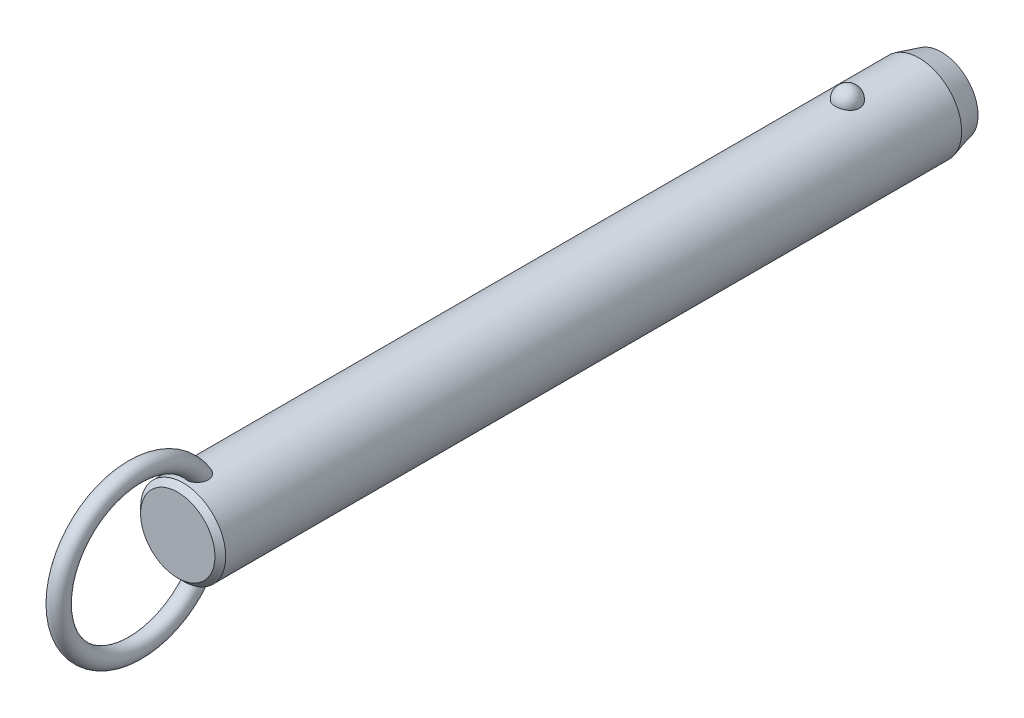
SolidWorks part; units mm, degrees
ref_plane "Front Plane" through (0, 0, 0) normal (0, 0, 1) x (1, 0, 0)
ref_plane "Top Plane" through (0, 0, 0) normal (0, 1, 0) x (1, 0, 0)
ref_plane "Right Plane" through (0, 0, 0) normal (1, 0, 0) x (0, 0, -1)
sketch "Sketch2" plane through (0, 0, 0) normal (0, 0, 1) x (1, 0, 0)
  circle A0 centre (0, 0) radius 9.5
  point P3 (0, 9.5)
  dimension "D1" = 19
extrude "Boss-Extrude1" add sketch "Sketch2" along normal blind 137.2
sketch "Sketch3" plane through (0, 0, 0) normal (0, 0, -1) x (-1, 0, 0)
  circle A0 centre (0, 0) radius 9.5
  dimension "D1" = 19
extrude "Boss-Extrude2" add sketch "Sketch3" along normal blind 23.7
chamfer "Chamfer1" distance 5 angle 15 1 edges at (-9.5, 0, -23.7)
sketch "Sketch12" plane through (0, 0, 0) normal (1, 0, 0) x (0, 0, -1)
  line L0 (-137.2, 9.5) -> (-137.2, -9.5) construction
  point P0 (-137.2, 0)
sketch "Sketch13" plane through (0, 0, 0) normal (1, 0, 0) x (0, 0, -1)
  circle A0 centre (-156.25, 0) radius 19.05
  point P2 (-137.2, 0)
  dimension "D1" = 38.1
sketch "Sketch14" plane through (0, 0, 0) normal (0, 1, 0) x (1, 0, 0)
  circle A0 centre (0, -139.2) radius 2
  point P2 (0, -137.2)
  dimension "D1" = 4
sweep "Sweep1" add profiles "Sketch14" path "Sketch13"
sketch "Sketch15" plane through (0, 0, 137.2) normal (0, 0, 1) x (1, 0, 0)
  circle A0 centre (0, 0) radius 9.5
  dimension "D1" = 19
extrude "Boss-Extrude3" add sketch "Sketch15" along normal blind 9.52
chamfer "Chamfer2" distance 1.2 angle 45 1 edges at (9.5, 0, 146.72)
sketch "Sketch18" plane through (0, 0, 0) normal (1, 0, 0) x (0, 0, -1)
  line L0 (18.7, 9.5) -> (-139.7378, 9.5) construction
  line L1 (2.7, 12.2) -> (2.7, 6.8)
  line L2 (-139.7378, -9.5) -> (18.7, -9.5) construction
  arc A0 (2.7, 12.2) -> (2.7, 6.8) centre (2.7, 9.5) ccw
  point P4 (0, 9.5)
  dimension "D1" = 21.7
revolve "Revolve1" add sketch "Sketch18" angle 360 about L1
